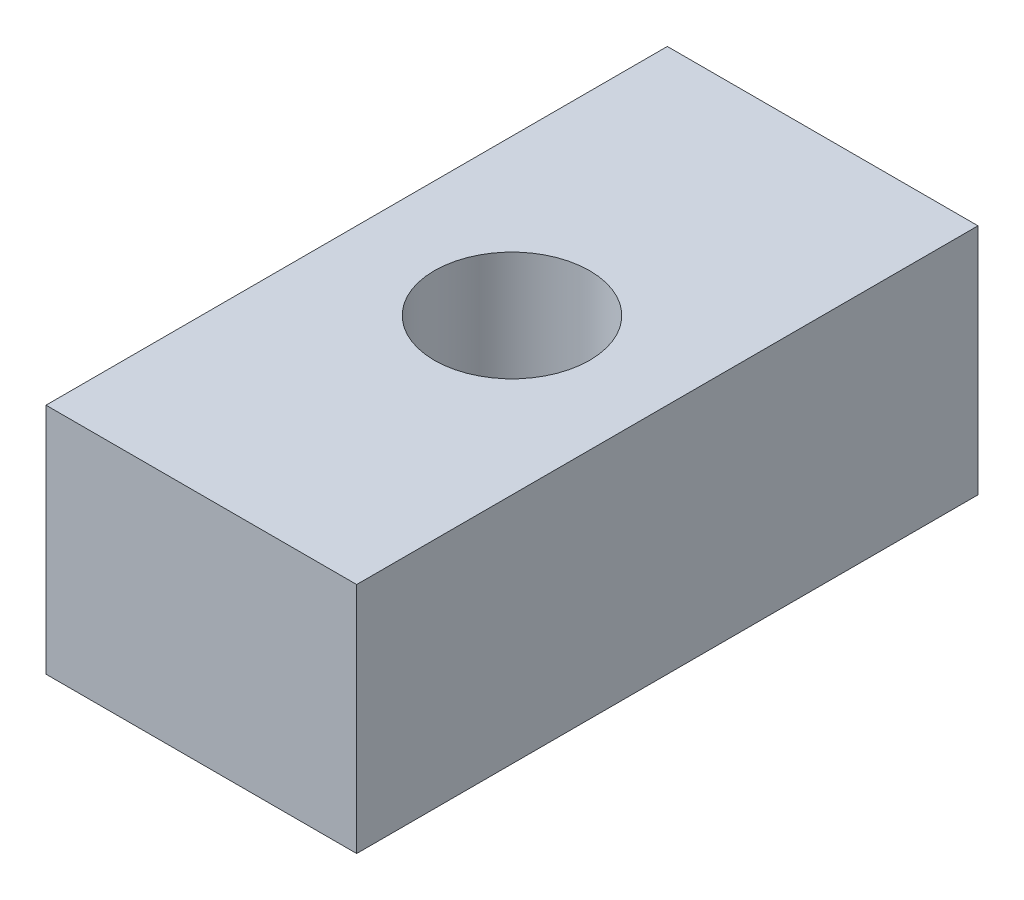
SolidWorks part; units mm, degrees
ref_plane "Front Plane" through (0, 0, 0) normal (0, 0, 1) x (1, 0, 0)
ref_plane "Top Plane" through (0, 0, 0) normal (0, 1, 0) x (1, 0, 0)
ref_plane "Right Plane" through (0, 0, 0) normal (1, 0, 0) x (0, 0, -1)
sketch "Sketch1" plane through (0, 0, 0) normal (0, 1, 0) x (1, 0, 0)
  line L0 (-12.7, -25.4) -> (12.7, 25.4) construction
  line L1 (-12.7, 25.4) -> (12.7, 25.4)
  line L2 (-12.7, 25.4) -> (-12.7, -25.4)
  line L3 (-12.7, -25.4) -> (12.7, -25.4)
  line L4 (12.7, 25.4) -> (12.7, -25.4)
  dimension "D1" = 25.4
  dimension "D2" = 50.8
extrude "Extrude1" add sketch "Sketch1" along normal blind 19.05
sketch "Sketch2" plane through (0, 19.05, 0) normal (0, 1, 0) x (-1, 0, 0)
  circle A0 centre (0, 0) radius 6.35
  dimension "D1" = 12.7
extrude "Cut-Extrude1" cut sketch "Sketch2" against normal blind 12.7
